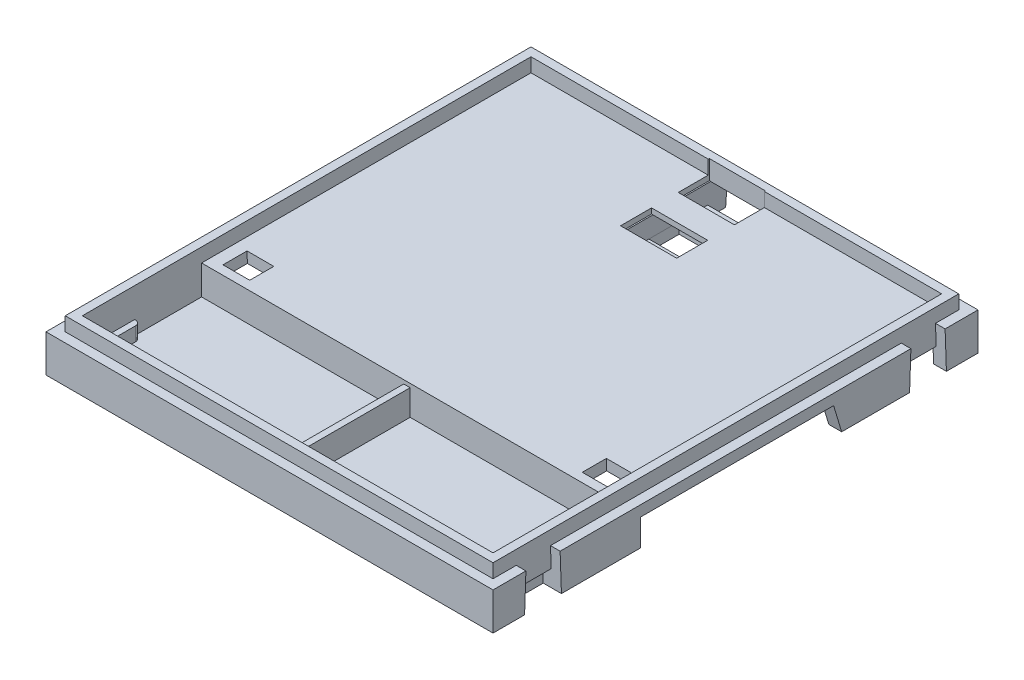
SolidWorks part; units mm, degrees
ref_plane "Спереди" through (0, 0, 0) normal (0, 0, 1) x (1, 0, 0)
ref_plane "Сверху" through (0, 0, 0) normal (0, 1, 0) x (1, 0, 0)
ref_plane "Справа" through (0, 0, 0) normal (1, 0, 0) x (0, 0, -1)
sketch "Эскиз1" plane through (0, 0, 0) normal (0, 1, 0) x (1, 0, 0)
  line L0 (0, 45.35) -> (0, -45.35) construction
  line L1 (41.8, -45.35) -> (-41.8, -45.35)
  line L2 (41.8, -45.35) -> (41.8, 45.35)
  line L3 (41.8, 45.35) -> (-41.8, 45.35)
  line L4 (-41.8, -45.35) -> (-41.8, 45.35)
  line L5 (41.8, -45.35) -> (-41.8, 45.35) construction
  line L6 (41.8, 45.35) -> (-41.8, -45.35) construction
  line L7 (-41.8, 0) -> (41.8, 0) construction
  point P0 (0, 0)
  dimension "D1" = 83.6
  dimension "D2" = 90.7
extrude "Бобышка-Вытянуть1" add sketch "Эскиз1" against normal blind 7
sketch "Эскиз2" plane through (0, 0, 0) normal (0, 1, 0) x (1, 0, 0)
  line L1 (40, -43.55) -> (-40, -43.55)
  line L2 (40, -43.55) -> (40, 43.55)
  line L3 (40, 43.55) -> (-40, 43.55)
  line L4 (-40, -43.55) -> (-40, 43.55)
  line L5 (40, -43.55) -> (-40, 43.55) construction
  line L6 (40, 43.55) -> (-40, -43.55) construction
  line L7 (38.4, -41.95) -> (-38.4, -41.95)
  line L8 (38.4, -41.95) -> (38.4, 41.95)
  line L9 (38.4, 41.95) -> (-38.4, 41.95)
  line L10 (-38.4, -41.95) -> (-38.4, 41.95)
  line L11 (38.4, -41.95) -> (-38.4, 41.95) construction
  line L12 (38.4, 41.95) -> (-38.4, -41.95) construction
  line L13 (-41.8, 45.35) -> (-41.8, -45.35) construction
  line L14 (41.8, 45.35) -> (-41.8, 45.35) construction
  line L15 (0, 0) -> (0, 45.35) construction
  line L16 (-5.25, 41.95) -> (-5.25, 42.15)
  line L17 (-5.25, 42.15) -> (5.25, 42.15)
  line L18 (5.25, 42.15) -> (5.25, 41.95)
  point P0 (0, 0)
  point P6 (0, 0)
  dimension "D1" = 1.8
  dimension "D2" = 1.8
  dimension "D3" = 1.6
  dimension "D4" = 1.6
  dimension "D5" = 10.5
  dimension "D6" = 0.2
extrude "Бобышка-Вытянуть2" add sketch "Эскиз2" along normal blind 2.6 contours L4 L1 L2 L3 L17 L18 L9 L8 L7 L10 L16
sketch "Эскиз3" plane through (0, 0, 0) normal (0, 1, 0) x (1, 0, 0)
  line L0 (38.4, -41.95) -> (38.4, 41.95) construction
  line L1 (-38.4, -41.95) -> (38.4, -41.95)
  line L2 (-38.4, -41.95) -> (-38.4, -19.65)
  line L3 (-38.4, -19.65) -> (38.4, -19.65)
  line L4 (38.4, -41.95) -> (38.4, -19.65)
  dimension "D1" = 22.3
extrude "Вырез-Вытянуть1" cut sketch "Эскиз3" against normal blind 5.5
sketch "Эскиз4" plane through (0, -5.5, 0) normal (0, 1, 0) x (1, 0, 0)
  line L0 (38.4, -19.65) -> (-38.4, -19.65) construction
  line L1 (-0.6, -19.65) -> (0.6, -19.65)
  line L2 (-0.6, -19.65) -> (-0.6, -41.95)
  line L3 (-0.6, -41.95) -> (0.6, -41.95)
  line L4 (0.6, -19.65) -> (0.6, -41.95)
  line L5 (38.4, -41.95) -> (-38.4, -41.95) construction
  line L6 (0, 0) -> (0, -45.35) construction
  line L7 (-41.8, -45.35) -> (41.8, -45.35) construction
  dimension "D1" = 1.2
extrude "Бобышка-Вытянуть3" add sketch "Эскиз4" along normal blind 4.8
sketch "Эскиз5" plane through (0, -5.5, 0) normal (0, 1, 0) x (1, 0, 0)
  line L0 (0, 0) -> (0, -45.35) construction
  line L1 (-41.8, -45.35) -> (41.8, -45.35) construction
  line L2 (38.4, -41.95) -> (-38.4, -41.95) construction
  line L3 (-9.45, -41.95) -> (-10.55, -41.95)
  line L4 (-9.45, -41.95) -> (-9.45, -39.95)
  line L5 (-9.45, -39.95) -> (-10.55, -39.95)
  line L6 (-10.55, -41.95) -> (-10.55, -39.95)
  line L8 (-28.6, -41.95) -> (-29.7, -41.95)
  line L9 (-28.6, -41.95) -> (-28.6, -39.95)
  line L10 (-28.6, -39.95) -> (-29.7, -39.95)
  line L11 (-29.7, -41.95) -> (-29.7, -39.95)
  line L12 (9.45, -41.95) -> (10.55, -41.95)
  line L13 (9.45, -41.95) -> (9.45, -39.95)
  line L14 (9.45, -39.95) -> (10.55, -39.95)
  line L15 (10.55, -41.95) -> (10.55, -39.95)
  line L16 (28.6, -41.95) -> (29.7, -41.95)
  line L17 (28.6, -41.95) -> (28.6, -39.95)
  line L18 (28.6, -39.95) -> (29.7, -39.95)
  line L19 (29.7, -41.95) -> (29.7, -39.95)
  dimension "D1" = 1.1
  dimension "D2" = 5.4
  dimension "D3" = 21.1
  dimension "D4" = 57.2
extrude "Бобышка-Вытянуть4" add sketch "Эскиз5" along normal blind 4.7
sketch "Эскиз6" plane through (0, -5.5, 0) normal (0, 1, 0) x (1, 0, 0)
  line L0 (0, 0) -> (0, -45.35) construction
  line L1 (-41.8, -45.35) -> (41.8, -45.35) construction
  line L2 (-38.4, -32.15) -> (-38.3, -32.15)
  line L4 (-38.4, -41.95) -> (-38.4, 41.95) construction
  line L5 (-37.3, -33.15) -> (-37.3, -38.85)
  line L6 (38.4, -32.15) -> (38.3, -32.15)
  line L7 (38.4, -41.95) -> (38.4, 41.95) construction
  line L8 (37.3, -33.15) -> (37.3, -38.85)
  line L9 (38.3, -39.85) -> (38.4, -39.85)
  line L10 (-38.3, -39.85) -> (-38.4, -39.85)
  line L11 (-41.8, 45.35) -> (-41.8, -45.35) construction
  line L12 (-38.4, -32.15) -> (-38.4, -39.85)
  line L13 (38.4, -32.15) -> (38.4, -39.85)
  line L21 (-41.8, -36) -> (-36.0571, -36) construction
  arc A0 (37.3, -38.85) -> (38.3, -39.85) centre (38.3, -38.85) ccw
  arc A1 (38.3, -32.15) -> (37.3, -33.15) centre (38.3, -33.15) ccw
  arc A2 (-37.3, -38.85) -> (-38.3, -39.85) centre (-38.3, -38.85) cw
  arc A3 (-37.3, -33.15) -> (-38.3, -32.15) centre (-38.3, -33.15) ccw
  point P27 (-37.3, -36)
  dimension "D3" = 1
  dimension "D1" = 7.7
  dimension "D2" = 4.5
  dimension "D4" = 9.35
extrude "Бобышка-Вытянуть5" add sketch "Эскиз6" along normal blind 2.6
sketch "Эскиз7" plane through (-41.8, 0, 0) normal (-1, 0, 0) x (0, 0, 1)
  line L0 (0, 2.6) -> (0, -7) construction
  line L1 (43.55, 2.6) -> (-43.55, 2.6) construction
  line L2 (-45.35, -7) -> (45.35, -7) construction
  line L3 (-39.2, 0) -> (-39.4444, -7)
  line L4 (-45.35, 0) -> (45.35, 0) construction
  line L5 (-39.2, 0) -> (-32.8, 0)
  line L6 (-32.8, 0) -> (-32.5556, -7)
  line L7 (-32.5556, -7) -> (-39.4444, -7)
  line L8 (32.5556, -7) -> (32.8, 0)
  line L9 (32.8, 0) -> (39.2, 0)
  line L10 (39.2, 0) -> (39.4444, -7)
  line L11 (39.4444, -7) -> (32.5556, -7)
  line L12 (36, 1.1548) -> (36, -8.4691) construction
  line L13 (45.35, -7) -> (45.35, 0) construction
  point P20 (36, 0)
  dimension "D1" = 92
  dimension "D2" = 9.35
  dimension "D3" = 6.4
extrude "Вырез-Вытянуть2" cut sketch "Эскиз7" against normal blind 1.8
mirror "Зеркальное отражение2" about plane through (0, 0, 0) normal (1, 0, 0) of "Вырез-Вытянуть2"
sketch "Эскиз8" plane through (0, -7, 0) normal (0, -1, 0) x (1, 0, 0)
  line L0 (-41.8, 17.75) -> (41.8, 17.75)
  line L1 (-41.8, -32.5556) -> (-41.8, 32.5556) construction
  line L2 (41.8, 32.5556) -> (41.8, -32.5556) construction
  line L3 (41.8, 17.75) -> (41.8, -18.35)
  line L4 (41.8, -18.35) -> (39.4, -18.35)
  line L5 (39.4, -18.35) -> (39.4, -43.35)
  line L6 (39.4, -43.35) -> (7.1, -43.35)
  line L7 (7.1, -43.35) -> (7.1, -24.75)
  line L8 (7.1, -24.75) -> (-7.1, -24.75)
  line L9 (-7.1, -24.75) -> (-7.1, -43.35)
  line L10 (-7.1, -43.35) -> (-39.4, -43.35)
  line L11 (-39.4, -43.35) -> (-39.4, -18.35)
  line L12 (-39.4, -18.35) -> (-41.8, -18.35)
  line L13 (-41.8, -18.35) -> (-41.8, 17.75)
  line L14 (0, 45.35) -> (0, -45.35) construction
  line L15 (-41.8, 45.35) -> (41.8, 45.35) construction
  line L16 (41.8, -45.35) -> (-41.8, -45.35) construction
  dimension "D1" = 27.6
  dimension "D2" = 14.2
  dimension "D3" = 42.5
  dimension "D4" = 27
  dimension "D5" = 2
  dimension "D6" = 2.4
extrude "Вырез-Вытянуть3" cut sketch "Эскиз8" against normal blind 5
sketch "Эскиз9" plane through (0, 0, -45.35) normal (0, 0, -1) x (-1, 0, 0)
  line L0 (0, 2.6) -> (0, -7) construction
  line L1 (-40, 2.6) -> (40, 2.6) construction
  line L2 (-41.8, -7) -> (41.8, -7) construction
  line L3 (-5, -1) -> (5, -1)
  line L4 (5, -1) -> (5.25, -4.8)
  line L5 (5.25, -4.8) -> (-5.25, -4.8)
  line L6 (-5.25, -4.8) -> (-5, -1)
  dimension "D1" = 3.6
  dimension "D2" = 2.2
  dimension "D3" = 10
  dimension "D4" = 10.5
extrude "Вырез-Вытянуть4" cut sketch "Эскиз9" against normal blind 52
sketch "Эскиз10" plane through (0, 0, -45.35) normal (0, 0, -1) x (-1, 0, 0)
  line L0 (-5.25, -4.8) -> (5.25, -4.8)
  line L1 (5.25, -4.8) -> (5.3947, -7)
  line L2 (-41.8, -7) -> (41.8, -7) construction
  line L3 (-5.3947, -7) -> (5.3947, -7)
  line L4 (-5.3947, -7) -> (-5.25, -4.8)
  line L5 (-5, -1) -> (-5.25, -4.8) construction
  line L6 (5.25, -4.8) -> (5, -1) construction
extrude "Вырез-Вытянуть5" cut sketch "Эскиз10" against normal blind 3.5
sketch "Эскиз11" plane through (40, 0, 0) normal (1, 0, 0) x (0, 0, -1)
  line L0 (32.5556, -7) -> (39.4444, -7)
  line L1 (39.4444, -7) -> (39.2698, -2)
  line L2 (39.2, 0) -> (39.4444, -7) construction
  line L3 (39.2698, -2) -> (32.7302, -2)
  line L4 (32.5556, -7) -> (32.8, 0) construction
  line L5 (32.7302, -2) -> (32.5556, -7)
  line L6 (43.35, -2) -> (18.35, -2) construction
extrude "Вырез-Вытянуть6" cut sketch "Эскиз11" against normal blind 0.6
sketch "Эскиз12" plane through (0, -2, 0) normal (0, -1, 0) x (1, 0, 0)
  line L0 (40, -39.2698) -> (40, -32.7302) construction
  line L1 (39.4, -31.7) -> (40, -31.7)
  line L2 (38.4, -32.7) -> (38.4, -39.3)
  line L3 (39.4, -40.3) -> (40, -40.3)
  line L4 (40, -31.7) -> (40, -40.3)
  line L5 (41.8, -18.35) -> (41.8, -32.5556) construction
  line L6 (41.8, -32.8) -> (41.8, -39.2) construction
  line L7 (41.8, -36) -> (34.0886, -36) construction
  arc A0 (38.4, -39.3) -> (39.4, -40.3) centre (39.4, -39.3) ccw
  arc A1 (39.4, -31.7) -> (38.4, -32.7) centre (39.4, -32.7) ccw
  point P16 (38.4, -40.3)
  point P19 (38.4, -31.7)
  dimension "D3" = 1
  dimension "D1" = 8.6
  dimension "D2" = 3.4
extrude "Бобышка-Вытянуть6" add sketch "Эскиз12" along normal blind 1.8
sketch "Эскиз13" plane through (-7.1, 0, 0) normal (-1, 0, 0) x (0, 0, 1)
  line L0 (-24.75, -7) -> (-24.75, -2)
  line L1 (-24.75, -2) -> (-25.25, -7)
  line L2 (-24.75, -7) -> (-43.35, -7) construction
  line L3 (-25.25, -7) -> (-24.75, -7)
  dimension "D1" = 0.5
extrude "Вырез-Вытянуть7" cut sketch "Эскиз13" against normal up to surface (14.2 mm away)
sketch "Эскиз14" plane through (40, 0, 0) normal (1, 0, 0) x (0, 0, -1)
  line L0 (-39.4444, -7) -> (-32.5556, -7)
  line L1 (-32.5556, -7) -> (-32.6673, -3.8)
  line L2 (-32.8, 0) -> (-32.5556, -7) construction
  line L3 (-32.6673, -3.8) -> (-39.3327, -3.8)
  line L4 (-39.4444, -7) -> (-39.2, 0) construction
  line L5 (-39.3327, -3.8) -> (-39.4444, -7)
  line L6 (39.3327, -3.8) -> (32.6673, -3.8) construction
extrude "Вырез-Вытянуть8" cut sketch "Эскиз14" against normal up to surface (1.6 mm away)
mirror "Зеркальное отражение3" about plane through (0, 0, 0) normal (1, 0, 0) of "Вырез-Вытянуть8", "Вырез-Вытянуть6", "Бобышка-Вытянуть6"
sketch "Эскиз15" plane through (0, -2, 0) normal (0, -1, 0) x (1, 0, 0)
  line L0 (0, 17.75) -> (0, 6.65) construction
  line L1 (41.8, 17.75) -> (-41.8, 17.75) construction
  line L2 (-5.0658, 6.65) -> (5.0658, 6.65) construction
  line L3 (-26.3, 14.55) -> (-11.3, 14.55) construction
  line L4 (-26.3, 15.55) -> (-11.3, 15.55)
  line L5 (-26.3, 13.55) -> (-11.3, 13.55)
  line L6 (11.3, 14.55) -> (26.3, 14.55) construction
  line L7 (11.3, 15.55) -> (26.3, 15.55)
  line L8 (11.3, 13.55) -> (26.3, 13.55)
  arc A0 (-26.3, 15.55) -> (-26.3, 13.55) centre (-26.3, 14.55) ccw
  arc A1 (-11.3, 13.55) -> (-11.3, 15.55) centre (-11.3, 14.55) ccw
  arc A2 (11.3, 15.55) -> (11.3, 13.55) centre (11.3, 14.55) ccw
  arc A3 (26.3, 13.55) -> (26.3, 15.55) centre (26.3, 14.55) ccw
  point P8 (-18.8, 14.55)
  point P13 (18.8, 14.55)
  point P20 (10.3, 14.55)
  point P21 (-10.3, 14.55)
  point P23 (-27.3, 14.55)
  dimension "D2" = 20.6
  dimension "D1" = 2
  dimension "D3" = 17
  dimension "D4" = 2.2
extrude "Бобышка-Вытянуть7" add sketch "Эскиз15" along normal blind 0.7
sketch "Эскиз16" plane through (0, -2, 0) normal (0, -1, 0) x (1, 0, 0)
  line L0 (0, 6.65) -> (0, -25.03) construction
  line L1 (-5.0658, 6.65) -> (5.0658, 6.65) construction
  line L2 (-5.25, -25.03) -> (5.25, -25.03) construction
  line L3 (-13.6, -23.35) -> (-13.6, -23.85) construction
  line L4 (-12.1, -23.35) -> (-12.1, -23.85)
  line L5 (-15.1, -23.35) -> (-15.1, -23.85)
  line L6 (13.6, -23.35) -> (13.6, -23.85) construction
  line L7 (15.1, -23.35) -> (15.1, -23.85)
  line L8 (12.1, -23.35) -> (12.1, -23.85)
  line L9 (-39.4, -43.35) -> (-7.1, -43.35) construction
  arc A0 (-12.1, -23.35) -> (-15.1, -23.35) centre (-13.6, -23.35) ccw
  arc A1 (-15.1, -23.85) -> (-12.1, -23.85) centre (-13.6, -23.85) ccw
  arc A2 (15.1, -23.35) -> (12.1, -23.35) centre (13.6, -23.35) ccw
  arc A3 (12.1, -23.85) -> (15.1, -23.85) centre (13.6, -23.85) ccw
  point P8 (-13.6, -23.6)
  point P13 (13.6, -23.6)
  point P21 (-13.6, -21.85)
  point P22 (-13.6, -25.35)
  dimension "D1" = 3
  dimension "D2" = 3.5
  dimension "D3" = 30.2
  dimension "D4" = 18
extrude "Бобышка-Вытянуть8" add sketch "Эскиз16" along normal blind 3
sketch "Эскиз17" plane through (0, 0, 0) normal (0, 1, 0) x (1, 0, 0)
  line L0 (5.25, 42.15) -> (5.25, 41.95) construction
  line L1 (-5.25, 42.15) -> (5.25, 42.15)
  line L2 (-5.25, 42.15) -> (-5.25, 36.35)
  line L3 (-5.25, 36.35) -> (5.25, 36.35)
  line L4 (5.25, 42.15) -> (5.25, 36.35)
  line L5 (-5.25, 31.35) -> (5.25, 31.35)
  line L6 (-5.25, 31.35) -> (-5.25, 25.55)
  line L7 (-5.25, 25.55) -> (5.25, 25.55)
  line L8 (5.25, 31.35) -> (5.25, 25.55)
  dimension "D1" = 5.8
  dimension "D2" = 5
extrude "Вырез-Вытянуть9" cut sketch "Эскиз17" against normal up to surface (1 mm away)
sketch "Эскиз18" plane through (0, -7, 0) normal (0, -1, 0) x (1, 0, 0)
  line L0 (-5.3947, -41.85) -> (-5.3947, -45.35) construction
  line L1 (-5.3947, -36.65) -> (5.3947, -36.65)
  line L2 (-5.3947, -36.65) -> (-5.3947, -30.85)
  line L3 (-5.3947, -30.85) -> (5.3947, -30.85)
  line L4 (5.3947, -36.65) -> (5.3947, -30.85)
  line L5 (5.3947, -41.85) -> (5.3947, -45.35) construction
  line L6 (5.3947, -41.85) -> (-5.3947, -41.85) construction
  dimension "D1" = 5.8
  dimension "D2" = 5.2
extrude "Вырез-Вытянуть10" cut sketch "Эскиз18" against normal up to surface (2.2 mm away)
sketch "Эскиз19" plane through (41.8, 0, 0) normal (1, 0, 0) x (0, 0, -1)
  line L0 (18.35, -2) -> (18.35, -7)
  line L1 (18.35, -7) -> (19.85, -7)
  line L2 (18.35, -7) -> (32.5556, -7) construction
  line L3 (19.85, -7) -> (18.35, -2)
  dimension "D1" = 1.5
extrude "Вырез-Вытянуть11" cut sketch "Эскиз19" against normal through all
sketch "Эскиз20" plane through (0, 0, 17.75) normal (0, 0, -1) x (-1, 0, 0)
  line L0 (-36.1, 0) -> (-35.9, -7)
  line L1 (-38.4, 0) -> (38.4, 0) construction
  line L2 (-41.8, -7) -> (41.8, -7) construction
  line L3 (-35.9, -7) -> (-31.3, -7)
  line L4 (-31.3, -7) -> (-31.1, 0)
  line L5 (-31.1, 0) -> (-36.1, 0)
  line L6 (31.1, 0) -> (31.3, -7)
  line L7 (31.3, -7) -> (35.9, -7)
  line L8 (35.9, -7) -> (36.1, 0)
  line L9 (36.1, 0) -> (31.1, 0)
  line L10 (0, -7) -> (0, 2.6) construction
  line L11 (-38.4, 2.6) -> (38.4, 2.6) construction
  dimension "D1" = 4.6
  dimension "D2" = 5
  dimension "D3" = 62.2
extrude "Вырез-Вытянуть12" cut sketch "Эскиз20" against normal blind 0.2 and the other way blind 4.3
ref_plane "Плоскость1" through (-33.6, -6, 0) normal (1, 0, 0) x (0, 0, -1)
sketch "Эскиз22" plane through (-33.6, -6, 0) normal (1, 0, 0) x (0, 0, -1)
  line L0 (-17.95, -1) -> (-17.95, 2.8)
  line L1 (-17.95, -1) -> (-17.95, 6) construction
  line L2 (-17.95, 2.8) -> (-15.35, 2.2)
  line L3 (-15.35, 2.2) -> (-15.35, -1)
  line L4 (-15.35, -1) -> (-17.95, -1)
  line L5 (-17.75, -1) -> (-17.75, 4) construction
  dimension "D1" = 3.8
  dimension "D2" = 2.4
  dimension "D3" = 3.2
extrude "Бобышка-Вытянуть10" add sketch "Эскиз22" along normal mid plane 1.8
sketch "Эскиз24" plane through (-33.6, -6, 0) normal (1, 0, 0) x (0, 0, -1)
  line L0 (-17.95, 2.6) -> (-15.25, 1)
  line L1 (-17.95, -1) -> (-17.95, 6) construction
  line L2 (-15.25, 1) -> (-15.25, -1)
  line L3 (-15.25, -1) -> (-17.95, -1)
  line L4 (-17.95, -1) -> (-17.95, 2.6)
  line L5 (-17.75, -1) -> (-17.75, 4) construction
  dimension "D1" = 2.5
  dimension "D2" = 2
  dimension "D3" = 3.6
extrude "Бобышка-Вытянуть11" add sketch "Эскиз24" along normal mid plane 5
sketch "Эскиз25" plane through (0, 0, 17.75) normal (0, 0, -1) x (-1, 0, 0)
  line L0 (31.1971, -3.4) -> (31.3, -7)
  line L1 (41.8, -7) -> (-41.8, -7) construction
  line L2 (31.3, -7) -> (30.4975, -7)
  line L3 (-31.3, -7) -> (31.1, -7) construction
  line L4 (30.4975, -7) -> (30.4975, -3.4)
  line L5 (30.4975, -3.4) -> (31.1971, -3.4)
  line L6 (36.0029, -3.4) -> (35.9, -7)
  line L7 (35.9, -7) -> (36.7416, -7)
  line L8 (36.1, -7) -> (41.8, -7) construction
  line L9 (36.7416, -7) -> (36.7416, -3.4)
  line L10 (36.7416, -3.4) -> (36.0029, -3.4)
extrude "Вырез-Вытянуть13" cut sketch "Эскиз25" along normal blind 5
mirror "Зеркальное отражение4" about plane through (0, 0, 0) normal (1, 0, 0) of "Бобышка-Вытянуть11", "Вырез-Вытянуть13", "Бобышка-Вытянуть10"
